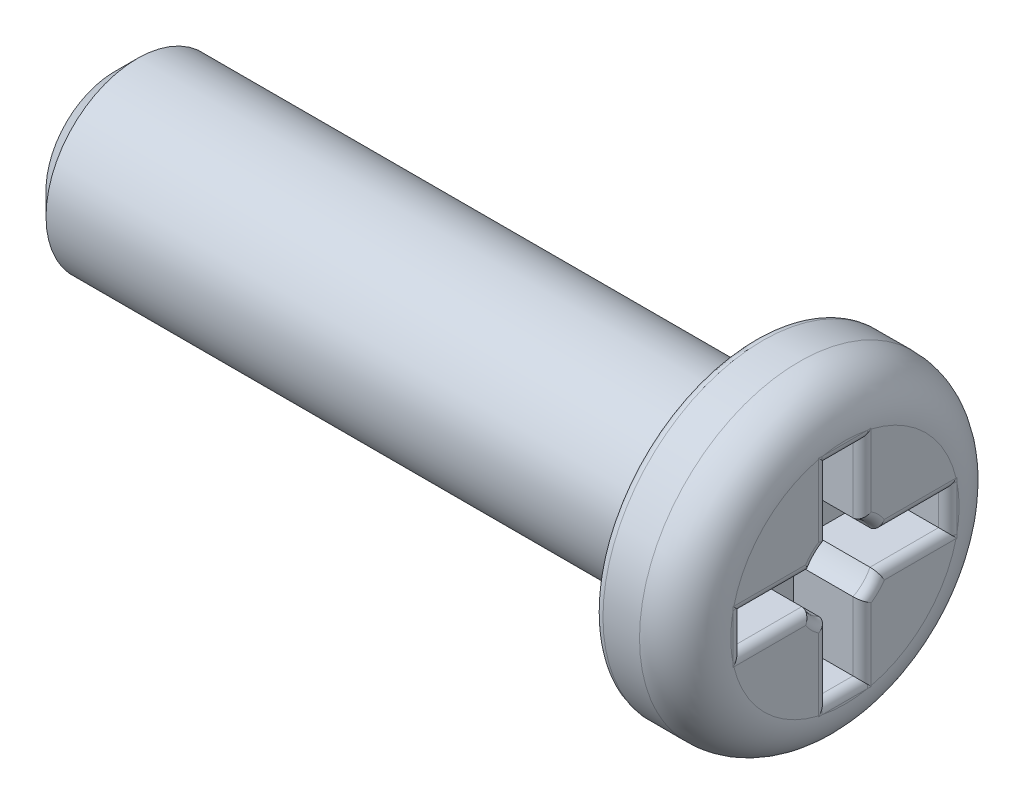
SolidWorks part; units mm, degrees
ref_plane "Face" through (0, 0, 0) normal (0, 0, 1) x (1, 0, 0)
ref_plane "Dessus" through (0, 0, 0) normal (0, 1, 0) x (1, 0, 0)
ref_plane "Droite" through (0, 0, 0) normal (1, 0, 0) x (0, 0, -1)
sketch "Esquisse1" plane through (0, 0, 0) normal (0, 0, 1) x (1, 0, 0)
  line L0 (0, 0) -> (5, 0) construction
  line L1 (0, 0) -> (0, 2)
  line L2 (0, 2) -> (14, 2)
  line L3 (14, 2) -> (14, 3.5)
  line L4 (14, 3.5) -> (15, 3.5)
  line L5 (16, 2.5) -> (16, 0)
  line L6 (0, 0) -> (16, 0)
  arc A0 (15, 3.5) -> (16, 2.5) centre (15, 2.5) cw
  point P10 (16, 3.5)
  dimension "D5" = 1
  dimension "D1" = 4
  dimension "D2" = 14
  dimension "D3" = 2
  dimension "D4" = 7
revolve "Révolution1" add sketch "Esquisse1" angle 360 about L0
sketch "Esquisse2" plane through (16, 0, 0) normal (1, 0, 0) x (0, 0, -1)
  line L0 (0, 0) -> (0, 2.6874) construction
  line L1 (0.375, 0) -> (-0.375, 0)
  line L2 (-0.375, 0) -> (-0.375, 2.25)
  line L3 (0.375, 0) -> (0.375, 2.25)
  line L4 (-0.375, 2.25) -> (0.375, 2.25)
  point P8 (0, 2.25)
  dimension "D1" = 0.75
  dimension "D2" = 2.25
extrude "Enlèv. mat.-Extru.1" cut sketch "Esquisse2" against normal blind 1.5
pattern_circular "Répétition circulaire1" count 4 over 360 about axis through (0, 0, 0) along (1, 0, 0)
sketch "Esquisse3" plane through (16, 0, 0) normal (1, 0, 0) x (0, 0, -1)
  circle A0 centre (0, 0) radius 0.8365
extrude "Enlèv. mat.-Extru.2" cut sketch "Esquisse3" against normal up to surface (1.5 mm away)
fillet "Congé2" radius 0.2
chamfer "Chanfrein1" distance 0.5 angle 45
